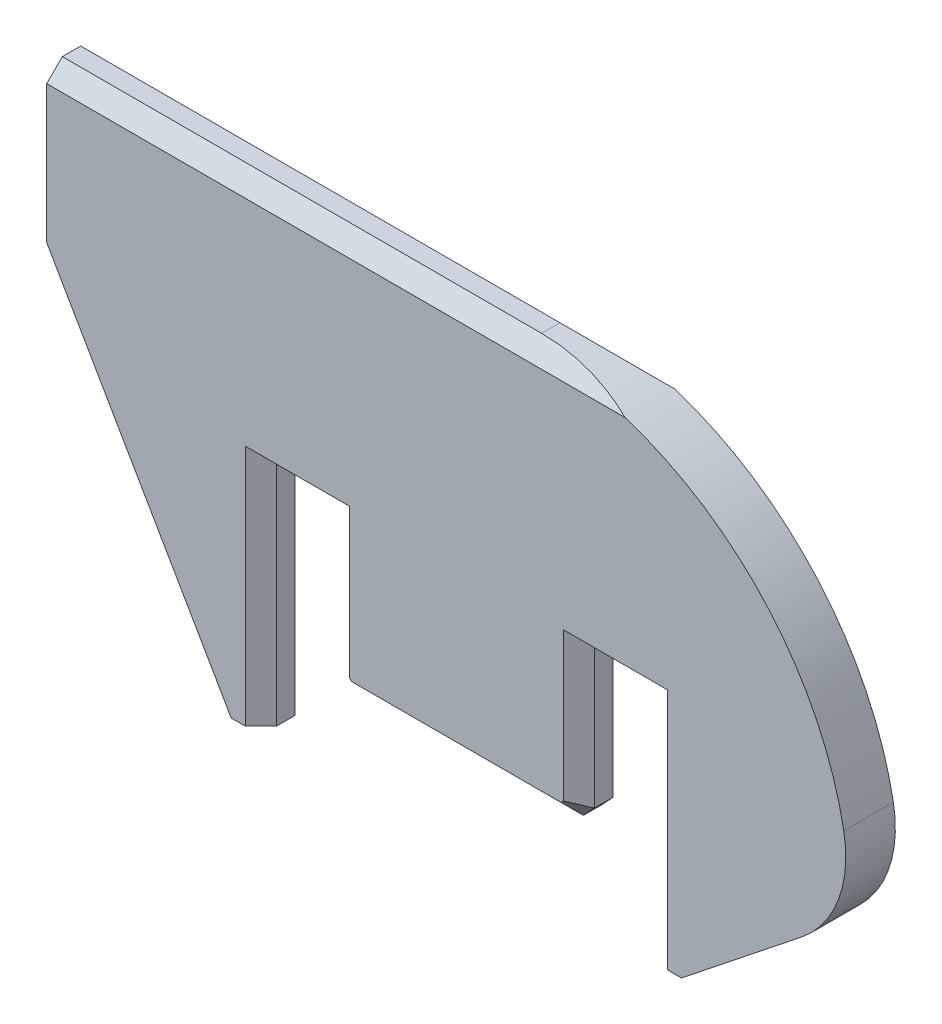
SolidWorks part; units mm, degrees
ref_plane "Front Plane" through (0, 0, 0) normal (1, 0, 0) x (0, 1, 0)
ref_plane "Top Plane" through (0, 0, 0) normal (0, 0, 1) x (0, 1, 0)
ref_plane "Right Plane" through (0, 0, 0) normal (0, 1, 0) x (-1, 0, 0)
sketch "sk w193" plane through (0, 0, 0) normal (0, 0, 1) x (0, 1, 0)
  line L1 (0, 196.596) -> (-453.9254, 196.596)
  line L2 (0, 196.596) -> (0, 247.396)
  line L3 (0, 247.396) -> (-453.9254, 247.396)
  line L4 (-453.9254, 196.596) -> (-453.9254, 247.396)
  line L6 (0, -196.596) -> (-453.9254, -196.596)
  line L7 (0, -196.596) -> (0, -247.396)
  line L8 (0, -247.396) -> (-453.9254, -247.396)
  line L9 (-453.9254, -196.596) -> (-453.9254, -247.396)
  point P0 (-399.034, -196.596)
  point P3 (-188.214, 0)
  point P11 (-399.034, 178.308)
  point P12 (-399.034, -178.308)
  line B0 (-399.034, -196.596) -> (-399.034, -160.02)
  line B1 (-399.034, -160.02) -> (-226.06, -160.02)
  line B2 (-210.82, -144.78) -> (-210.82, 144.78)
  line B3 (-226.06, 160.02) -> (-399.034, 160.02)
  line B4 (-399.034, 160.02) -> (-399.034, 196.596)
  line B5 (-399.034, 196.596) -> (0, 196.596)
  line B6 (0, 196.596) -> (0, 160.02)
  line B7 (0, 160.02) -> (-172.974, 160.02)
  line B8 (-188.214, 144.78) -> (-188.214, -144.78)
  line B9 (-172.974, -160.02) -> (0, -160.02)
  line B10 (0, -160.02) -> (0, -196.596)
  line B11 (0, -196.596) -> (-399.034, -196.596)
  arc B12 (-226.06, -160.02) -> (-210.82, -144.78) centre (-226.06, -144.78) ccw
  arc B13 (-210.82, 144.78) -> (-226.06, 160.02) centre (-226.06, 144.78) ccw
  arc B14 (-172.974, 160.02) -> (-188.214, 144.78) centre (-172.974, 144.78) ccw
  arc B15 (-188.214, -144.78) -> (-172.974, -160.02) centre (-172.974, -144.78) ccw
  dimension "D1" = 50.8
  dimension "D2" = 50.8
sketch_block_instance "w14x193-1-1"
sketch_block "w14x193-1" parameters "D4"=15.24, "D1"=399.034, "D2"=393.192, "D3"=22.606, "D5"=36.576
sketch "Sketch2" plane through (0, 0, 0) normal (0, 0, 1) x (0, 1, 0)
  line L0 (320, 524.8782) -> (320, -858.5231)
  line L6 (5, 250.396) -> (5, 157.02)
  line L7 (0, 196.596) -> (0, 160.02) construction
  line L8 (5, -157.02) -> (5, -250.396)
  line L9 (-285.82, 250.396) -> (5, 250.396)
  line L10 (-285.82, -250.396) -> (5, -250.396)
  line L11 (-285.82, 250.396) -> (-285.82, 288.496)
  line L12 (-285.82, 288.496) -> (123.6059, 524.8782)
  line L13 (-285.82, -250.396) -> (-285.82, -288.496)
  line L14 (-285.82, -288.496) -> (167.6, -858.5231)
  line L15 (-210.82, -144.78) -> (-210.82, 144.78) construction
  line L16 (0, 160.02) -> (-172.974, 160.02) construction
  line L17 (320, 524.8782) -> (123.6059, 524.8782)
  line L19 (320, -858.5231) -> (167.6, -858.5231)
  line L20 (320, 56.991) -> (909.0162, 56.991) construction
  line L21 (0, 247.396) -> (-453.9254, 247.396) construction
  line L22 (0, -247.396) -> (-453.9254, -247.396) construction
  line L23 (5, -157.02) -> (-172.974, -157.02)
  line L27 (-172.974, 157.02) -> (5, 157.02)
  line L29 (-172.974, 157.02) -> (-188.214, 142.78)
  line L30 (-188.214, 144.78) -> (-188.214, -144.78) construction
  line L31 (-172.974, -157.02) -> (-188.214, -142.78)
  line L32 (-172.974, -160.02) -> (0, -160.02) construction
  line L33 (-188.214, 142.78) -> (-188.214, -142.78)
  dimension "D1" = 320
  dimension "D2" = 5
  dimension "D3" = 75
  dimension "D4" = 3
  dimension "D5" = 3
  dimension "D6" = 30
  dimension "D7" = 51.5
  dimension "D8" = 38.1
  dimension "D9" = 38.1
  dimension "D10" = 467.8872
  dimension "D11" = 915.5141
  dimension "D12" = 3
  dimension "D13" = 2
  dimension "D14" = 2
  dimension "D15" = 3
extrude "Boss-Extrude1" add sketch "Sketch2" along normal mid plane 63.5
sketch "Sketch3" plane through (0, 0, 0) normal (0, 0, 1) x (0, 1, 0)
  line L1 (-115.2146, -502.9764) -> (-115.2146, -867.5634)
  line L2 (-115.2146, -867.5634) -> (320, -867.5634)
  line L3 (320, -867.5634) -> (320, -89.2619)
  line L5 (-285.82, -288.496) -> (167.6, -858.5231) construction
  line L6 (320, 524.8782) -> (320, -858.5231) construction
  line L7 (167.6, -858.5231) -> (320, -858.5231) construction
  line L8 (320, -858.5231) -> (320, 524.8782) construction
  arc A0 (-115.2146, -502.9764) -> (320, -89.2619) centre (-94.2455, -89.2619) ccw
  circle A1 centre (5, -250.396) radius 225 construction
  dimension "D2" = 450
  dimension "D1" = 304.8
  dimension "D3" = 769.2612
extrude "Cut-Extrude1" cut sketch "Sketch3" against normal through all both and the other way through all
fillet "Fillet1" radius 150 1 edges at (502.9764, -115.2146, 0)
chamfer "Chamfer2" distance 20 angle 45 18 edges at (250.396, -140.41, -31.75) (203.708, 5, -31.75) (157.02, -83.987, -31.75) (149.9, -180.594, -31.75) (0, -188.214, -31.75) (-149.9, -180.594, -31.75) (-157.02, -83.987, -31.75) (-203.708, 5, -31.75) (-250.396, -140.41, -31.75) (250.396, -140.41, 31.75) (203.708, 5, 31.75) (157.02, -83.987, 31.75) (149.9, -180.594, 31.75) (0, -188.214, 31.75) (-149.9, -180.594, 31.75) (-157.02, -83.987, 31.75) (-250.396, -140.41, 31.75) (-203.708, 5, 31.75)
chamfer "Chamfer3" distance 20 angle 45 2 edges at (-217.8081, 320, -31.75) (-217.8081, 320, 31.75)
